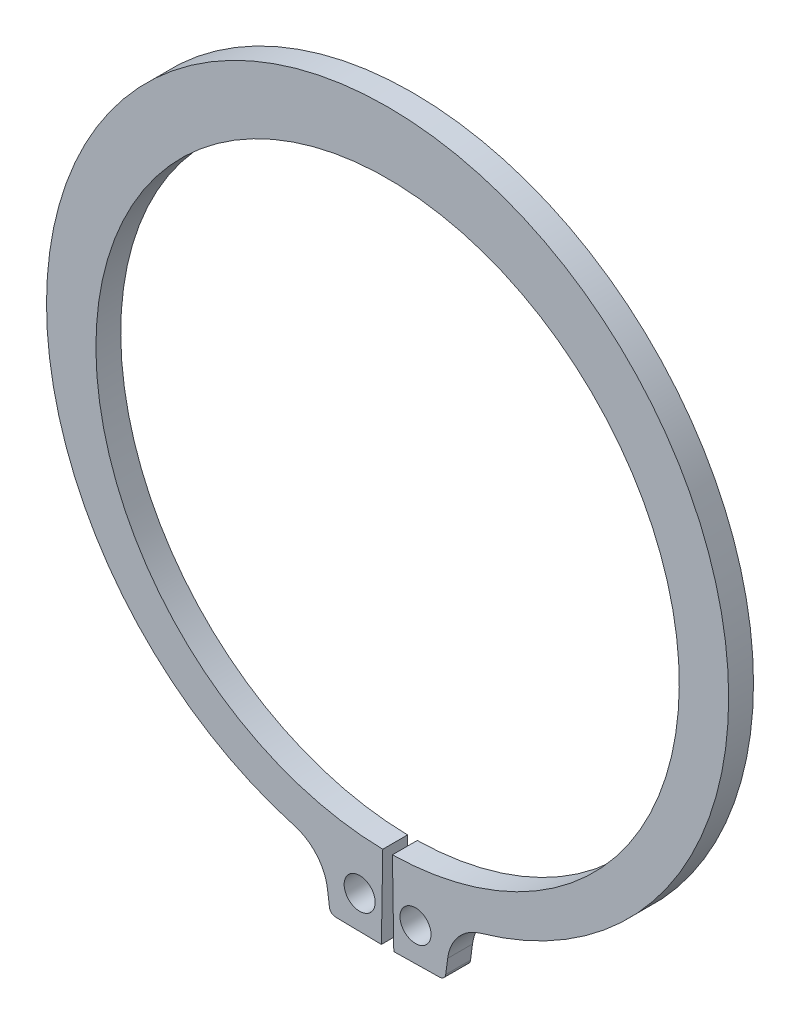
SolidWorks part; units mm, degrees
ref_plane "Plane1" through (0, 0, 0) normal (0, 0, 1) x (1, 0, 0)
ref_plane "Plane2" through (0, 0, 0) normal (0, 1, 0) x (1, 0, 0)
ref_plane "Plane3" through (0, 0, 0) normal (1, 0, 0) x (0, 0, -1)
extrude "Body" add sketch "BodySke" against normal blind 2
sketch "BodySke" plane through (0, 0, 0) normal (0, 0, 1) x (1, 0, 0)
  line L0 (-1.5431, 0) -> (1.5431, 0) construction
  line L1 (0, 0) -> (0, 28.5) construction
  line L2 (0.3891, -23.4968) -> (0.5, -30.1959)
  line L3 (-0.3891, -23.4968) -> (-0.5, -30.1959)
  line L4 (0, 0) -> (8.5096, -28.9763) construction
  line L5 (0, 0) -> (-8.5096, -28.9763) construction
  line L6 (0.5, -30.1959) -> (4.1951, -30.1347)
  line L7 (4.8414, -28.4934) -> (4.6826, -29.7)
  line L8 (-4.8414, -28.4934) -> (-4.6826, -29.7)
  line L9 (-0.5, -30.1959) -> (-4.1951, -30.1347)
  circle A0 centre (0, 0) radius 23.5 construction
  arc A1 (0.3891, -23.4968) -> (-0.3891, -23.4968) centre (0, 0) ccw
  arc A2 (7.467, -25.4262) -> (-7.467, -25.4262) centre (0, 1.0199) ccw construction
  arc A3 (0.5, -30.1959) -> (7.5626, -29.2378) centre (0, 0) ccw construction
  arc A4 (7.4998, -25.417) -> (4.8414, -28.4934) centre (8.5096, -28.9763) ccw
  arc A5 (-4.8414, -28.4934) -> (-7.4998, -25.417) centre (-8.5096, -28.9763) ccw
  arc A6 (-7.5626, -29.2378) -> (-0.5, -30.1959) centre (0, 0) ccw construction
  arc A7 (7.4998, -25.417) -> (-7.4998, -25.417) centre (0, 1.0199) ccw
  arc A8 (-5.0196, -27.1397) -> (5.0196, -27.1397) centre (0, 0) ccw construction
  circle A9 centre (2.25, -27.5081) radius 1.25
  circle A10 centre (-2.25, -27.5081) radius 1.25
  arc A11 (4.6826, -29.7) -> (4.1951, -30.1347) centre (4.1868, -29.6347) cw
  arc A12 (-4.6826, -29.7) -> (-4.1951, -30.1347) centre (-4.1868, -29.6347) ccw
  point P28 (4.6645, -29.8376)
  point P31 (-4.6645, -29.8376)
  dimension "GrooveDia" = 47
  dimension "D3" = 0.5
  dimension "LugRad" = 30.2
  dimension "HoleOffsetRad" = 27.6
  dimension "HoleDia" = 2.5
  dimension "D2" = 15
  dimension "LargeRad" = 28.5
  dimension "SmallRad" = 26.5
  dimension "Gap" = 1
  dimension "SmallAngle" = 32.732
  dimension "HoleSpacing" = 4.5
sketch "Clipboard" plane through (0, 0, 0) normal (0, 0, 1) x (1, 0, 0)
  line L0 (0, 0) -> (5, 0)
  line L1 (0, 0) -> (0, 3)
  line L2 (0, 0) -> (0, -6.7)
  circle A0 centre (0, 0) radius 1.25
  circle A1 centre (0, 0) radius 25
  dimension "HoleDia" = 2.5
  dimension "ShaftDia" = 50
  dimension "LargeSection" = 5
  dimension "SmallSection" = 3
  dimension "LugSection" = 6.7
equation "' \"ShaftDia@Clipboard\" = 10"
equation "' \"Thickness@Body\" = 1"
equation "' \"GrooveDia@BodySke\" = 9.6"
equation "' \"LugSection@Clipboard\" = 3.0"
equation "' \"LargeSection@Clipboard\" = 1.6"
equation "' \"HoleDia@Clipboard\" = 1.2"
equation "\"SmallSection@Clipboard\" =  \"LargeSection@Clipboard\" * 0.6"
equation "\"Gap@BodySke\" =  \"Thickness@Body\" / 2"
equation "\"LargeRad@BodySke\" =  \"GrooveDia@BodySke\" / 2 +  \"LargeSection@Clipboard\""
equation "\"SmallRad@BodySke\" =  \"GrooveDia@BodySke\" / 2 +  \"SmallSection@Clipboard\""
equation "\"LugRad@BodySke\" = \"GrooveDia@BodySke\" / 2 + \"LugSection@Clipboard\""
equation "\"HoleOffsetRad@BodySke\" = (  \"ShaftDia@Clipboard\" / 2 + \"LugRad@BodySke\" ) / 2"
equation "\"HoleSpacing@BodySke\" = \"Gap@BodySke\"  * 2 +  \"HoleDia@Clipboard\""
equation "\"HoleDia@BodySke\" =  \"HoleDia@Clipboard\""
equation "\"SmallAngle@BodySke\" = atn(\"HoleSpacing@BodySke\" / 2 / sqr(\"HoleOffsetRad@BodySke\"  * \"HoleOffsetRad@BodySke\" - (\"HoleSpacing@BodySke\" / 2) * (\"HoleSpacing@BodySke\" / 2) ))  * 7 * ( 180 / 3.141593)"
